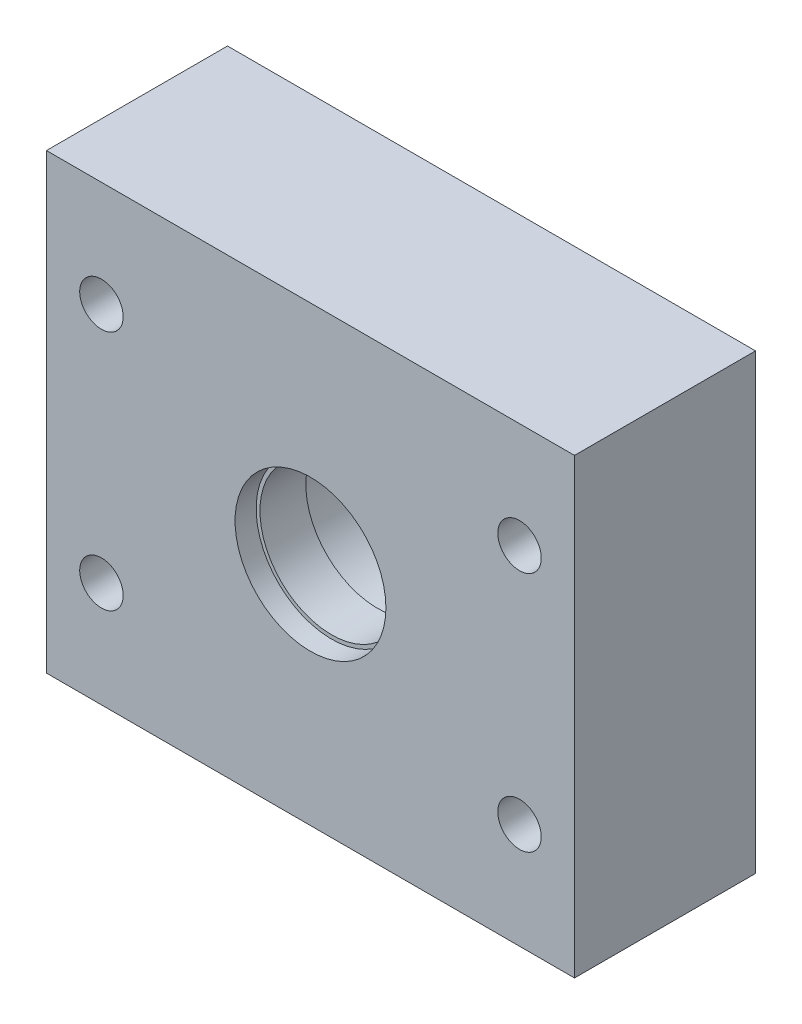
SolidWorks part; units mm, degrees
ref_plane "Front Plane" through (0, 0, 0) normal (0, 0, 1) x (1, 0, 0)
ref_plane "Top Plane" through (0, 0, 0) normal (0, 1, 0) x (1, 0, 0)
ref_plane "Right Plane" through (0, 0, 0) normal (1, 0, 0) x (0, 0, -1)
sketch "Sketch1" plane through (0, 0, 0) normal (0, 0, 1) x (1, 0, 0)
  line L1 (0, 0) -> (44.45, 0)
  line L2 (0, 0) -> (0, 38.1)
  line L3 (0, 38.1) -> (44.45, 38.1)
  line L4 (44.45, 0) -> (44.45, 38.1)
  dimension "D1" = 38.1
  dimension "D2" = 44.45
extrude "Extrude1" add sketch "Sketch1" along normal blind 15.24
sketch "Sketch2" plane through (0, 0, 15.24) normal (0, 0, 1) x (1, 0, 0)
  line L0 (44.45, 0) -> (44.45, 38.1) construction
  line L1 (44.45, 38.1) -> (0, 38.1) construction
  circle A0 centre (22.225, 19.05) radius 2.3495
  dimension "D1" = 4.699
  dimension "D2" = 22.225
  dimension "D3" = 19.05
sketch "Sketch4" plane through (0, 0, 15.24) normal (0, 0, 1) x (1, 0, 0)
  line L0 (22.225, 19.05) -> (0.6859, 19.05) construction
  line L1 (22.225, 19.05) -> (4.6274, 8.89) construction
  circle A0 centre (4.6274, 8.89) radius 1.8288
  dimension "D3" = 3.6576
  dimension "D1" = 20.32
  dimension "D2" = 30
sketch "Sketch6" plane through (0, 0, 15.24) normal (0, 0, 1) x (1, 0, 0)
  circle A0 centre (4.6274, 8.89) radius 1.8288
extrude "Cut-Extrude3" cut sketch "Sketch6" against normal through all
sketch "Sketch7" plane through (0, 0, 15.24) normal (0, 0, 1) x (1, 0, 0)
  line L0 (22.225, 19.05) -> (4.6274, 29.21) construction
  line L1 (22.225, 19.05) -> (0.6859, 19.05) construction
  line L2 (22.225, 19.05) -> (41.9056, 19.05) construction
  line L3 (22.225, 19.05) -> (39.8226, 29.21) construction
  line L4 (22.225, 19.05) -> (39.8226, 8.89) construction
  circle A0 centre (4.6274, 29.21) radius 1.8288
  circle A1 centre (39.8226, 29.21) radius 1.8288
  circle A2 centre (39.8226, 8.89) radius 1.8288
  dimension "D1" = 3.6576
  dimension "D4" = 3.6576
  dimension "D6" = 3.6576
  dimension "D2" = 20.32
  dimension "D3" = 30
  dimension "D5" = 20.32
  dimension "D7" = 20.32
  dimension "D8" = 30
  dimension "D9" = 30
extrude "Cut-Extrude4" cut sketch "Sketch7" against normal through all
sketch "Sketch5" plane through (0, 0, 15.24) normal (0, 0, 1) x (1, 0, 0)
  circle A0 centre (22.225, 19.05) radius 2.3495
extrude "Cut-Extrude2" cut sketch "Sketch5" against normal through all
sketch "Sketch9" plane through (0, 0, 15.24) normal (0, 0, 1) x (1, 0, 0)
  circle A0 centre (22.225, 19.05) radius 6.0325
  dimension "D1" = 12.065
extrude "Cut-Extrude5" cut sketch "Sketch9" against normal through all
sketch "Sketch10" plane through (0, 0, 15.24) normal (0, 0, 1) x (1, 0, 0)
  circle A0 centre (22.225, 19.05) radius 6.35
  dimension "D1" = 12.7
extrude "Cut-Extrude7" cut sketch "Sketch10" against normal blind 1.778
sketch "Sketch11" plane through (0, 0, 0) normal (0, 0, -1) x (-1, 0, 0)
  circle A0 centre (-22.225, 19.05) radius 6.35
  dimension "D1" = 12.7
extrude "Cut-Extrude8" cut sketch "Sketch11" against normal blind 9.6012
